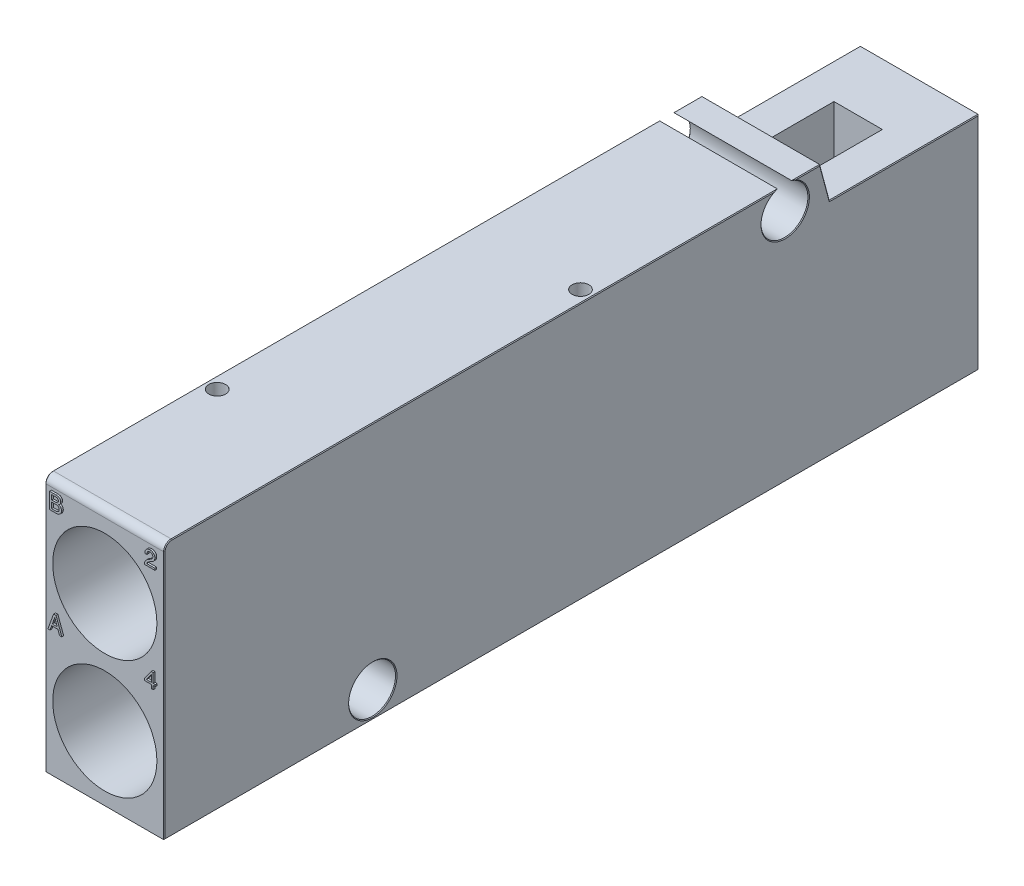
SolidWorks part; units mm, degrees
ref_plane "Front" through (0, 0, 0) normal (0, 0, 1) x (1, 0, 0)
ref_plane "Top" through (0, 0, 0) normal (0, 1, 0) x (1, 0, 0)
ref_plane "Right" through (0, 0, 0) normal (1, 0, 0) x (0, 0, -1)
sketch "Base_Sketch" plane through (0, 0, 0) normal (1, 0, 0) x (0, 0, -1)
  line L0 (-54.7, -17.25) -> (54.7, 17.25) construction
  line L1 (-54.7, 17.25) -> (54.7, 17.25)
  line L2 (-54.7, 17.25) -> (-54.7, -17.25)
  line L3 (-54.7, -17.25) -> (54.7, -17.25)
  line L4 (54.7, 17.25) -> (54.7, -17.25)
  dimension "Length" = 109.4
  dimension "Height" = 34.5
extrude "Base" add sketch "Base_Sketch" along normal mid plane 16
sketch "Valve Cut_Sketch" plane through (0, 0, 0) normal (1, 0, 0) x (0, 0, -1)
  line L0 (33.4138, 17.25) -> (34.7, 12.45)
  line L1 (54.7, 17.25) -> (-54.7, 17.25) construction
  line L2 (34.7, 12.45) -> (54.7, 12.45)
  line L3 (54.7, -17.25) -> (54.7, 17.25) construction
  dimension "Dist" = 20
  dimension "Height" = 4.8
  dimension "Angle" = 75
extrude "Valve Cut" cut sketch "Valve Cut_Sketch" against normal through all and the other way through all
sketch "Valve Connector_Sketch" plane through (0, 12.45, 0) normal (0, 1, 0) x (-1, 0, 0)
  line L0 (0, 0) -> (0, -53.7788) construction
  line L1 (-8, -54.7) -> (8, -54.7) construction
  line L2 (3.25, -37.7) -> (-3.25, -37.7)
  line L3 (3.25, -37.7) -> (3.25, -46.5)
  line L4 (3.25, -46.5) -> (-3.25, -46.5)
  line L5 (-3.25, -37.7) -> (-3.25, -46.5)
  dimension "Length" = 8.8
  dimension "Width" = 6.5
  dimension "Loc" = 8.2
extrude "Valve Connector" cut sketch "Valve Connector_Sketch" against normal blind 8
sketch "Bottom Angle_Sketch" [suppressed] plane through (0, 0, 0) normal (1, 0, 0) x (0, 0, -1)
  line L0 (-42.1, -20.5) -> (-56.1, -18.0314)
  line L1 (-56.1, -20.5) -> (56.1, -20.5) construction
  line L2 (-56.1, 20.5) -> (-56.1, -20.5) construction
  dimension "Angle" = 10
  dimension "Loc" = 14
extrude "Bottom Angle" [suppressed] cut sketch "Bottom Angle_Sketch" against normal through all and the other way through all
sketch "Rail Groove_Sketch" [suppressed] plane through (0, 0, 0) normal (1, 0, 0) x (0, 0, -1)
  line L0 (-28.5, -20.5) -> (-28.5, -17.3527)
  line L1 (-42.1, -20.5) -> (56.1, -20.5) construction
  line L2 (-28.5, -17.3527) -> (-30.5, -17)
  line L3 (-30.5, -17) -> (-30.5, -15.5)
  line L4 (-30.5, -15.5) -> (4.5, -15.5)
  line L5 (4.5, -15.5) -> (4.5, -20.5)
  line L6 (4.5, -20.5) -> (-28.5, -20.5)
  line L8 (-56.1, -18.0314) -> (-42.1, -20.5) construction
  line L9 (56.1, -20.5) -> (56.1, 15.7) construction
  point P12 (-13, -15.5)
  dimension "Width" = 35
  dimension "Bot_Width" = 33
  dimension "Height" = 6.3
  dimension "Groove_Height" = 1.5
  dimension "Loc" = 69.1
extrude "Rail Groove" [suppressed] cut sketch "Rail Groove_Sketch" against normal through all and the other way through all
sketch "Guide Holes_Sketch" plane through (0, 0, 0) normal (1, 0, 0) x (0, 0, -1)
  line L0 (54.7, -17.25) -> (54.7, 12.45) construction
  line L1 (33.4138, 17.25) -> (-54.7, 17.25) construction
  line L2 (-54.7, 17.25) -> (-54.7, -17.25) construction
  line L3 (-54.7, -17.25) -> (54.7, -17.25) construction
  circle A0 centre (28.7, 14.25) radius 3.15
  circle A1 centre (-26.7, -13.75) radius 3.15
  dimension "Dia" = 6.3
  dimension "Loc_Z" = 26
  dimension "Loc_Y" = 3
  dimension "Loc_Z-Bot" = 28
  dimension "Loc_Y-Bot" = 3.5
extrude "Guide Holes" cut sketch "Guide Holes_Sketch" against normal through all and the other way through all
fillet "Radius" radius 1 1 edges at (0, 17.25, 54.7)
sketch "2_Sketch" plane through (-1.8149, 2.2956, 54.7) normal (0, 0, 1) x (1, 0, 0)
  line L1 (-6.1851, 14.9544) -> (9.8149, 14.9544) construction
  line L2 (9.8149, 13.9544) -> (9.8149, -19.5456) construction
  text T0 "2"
  dimension "D1" = 2.5
  dimension "Loc_Y" = 3.5
extrude "2" add sketch "2_Sketch" along normal blind 0.25
sketch "B_Sketch" plane through (0, 0, 54.7) normal (0, 0, 1) x (1, 0, 0)
  line L1 (-8, 16.25) -> (-8, -17.25) construction
  text T0 "B"
  dimension "D1" = 0.6
extrude "B" add sketch "B_Sketch" against normal up to surface (0.25 mm away)
sketch "4_Sketch" plane through (0, 0, 54.7) normal (0, 0, 1) x (1, 0, 0)
  line L0 (8, -17.25) -> (-8, -17.25) construction
  text T0 "4"
  dimension "Loc_Y" = 17
extrude "4" add sketch "4_Sketch" against normal up to surface (0.25 mm away)
sketch "A_Sketch" plane through (0, 0, 54.7) normal (0, 0, 1) x (1, 0, 0)
  line L0 (8, -17.25) -> (-8, -17.25) construction
  text T0 "A"
  dimension "D1" = 17
extrude "A" add sketch "A_Sketch" against normal up to surface (0.25 mm away)
sketch "Fitting Hole_Sketch" plane through (0, 0, 54.7) normal (0, 0, 1) x (1, 0, 0)
  line L0 (8, -17.25) -> (-8, -17.25) construction
  circle A0 centre (0, 7.45) radius 7
  circle A1 centre (0, -8.55) radius 7
  dimension "Dia" = 14
  dimension "Loc_Y-Bot" = 8.7
  dimension "Loc_Y-Top" = 24.7
extrude "Fitting Hole" cut sketch "Fitting Hole_Sketch" against normal blind 14.6
sketch "Latch Cut_Sketch" [suppressed] plane through (0, 0, -56.1) normal (0, 0, -1) x (-1, 0, 0)
  line L0 (8, -20.5) -> (8, 15.7) construction
  line L1 (-8, 13.5) -> (8, 13.5)
  line L2 (-8, 13.5) -> (-8, 8.5)
  line L3 (-8, 8.5) -> (8, 8.5)
  line L4 (8, 13.5) -> (8, 8.5)
  line L5 (-8, -20.5) -> (-8, 15.7) construction
  line L6 (-8, -20.5) -> (8, -20.5) construction
  dimension "Loc_Y" = 29
  dimension "Height" = 5
extrude "Latch Cut" [suppressed] cut sketch "Latch Cut_Sketch" against normal blind 4.6
sketch "Latch_Sketch" [suppressed] plane through (0, 8.5, 0) normal (0, 1, 0) x (-1, 0, 0)
  line L0 (7.75, -51.5) -> (7.75, -55.85)
  line L1 (8, -51.5) -> (-8, -51.5) construction
  line L2 (7.75, -55.85) -> (1.95, -55.85)
  line L3 (8, -56.1) -> (8, -36.1) construction
  line L4 (7.75, -53.675) -> (8, -53.675) construction
  line L5 (4.85, -55.85) -> (4.85, -56.1) construction
  line L6 (-8, -56.1) -> (8, -56.1) construction
  dimension "Length" = 5.8
  dimension "Offset" = 0.25
extrude "Latch" [suppressed] add sketch "Latch_Sketch" along normal up to surface (5 mm away) thin
chamfer "Chamfer1" distance 0.1 angle 45 20 edges at (8, -2.4, -54.7) (-8, 17.25, -31.5372) (-8, 12.45, -44.7) (-8, 14.85, -34.0569) (8, 17.25, -31.5372) (8, 14.85, -34.0569) (8, 12.45, -44.7) (-8, 17.25, 12.9802) (-8, 11.1, -28.7) (8, 17.25, 12.9802) (8, 11.1, -28.7) (-8, -2.4, -54.7) (-8, -13.75, 23.55) (8, -13.75, 23.55) (-8, -17.25, 0) (-8, -0.5, 54.7) (8, -0.5, 54.7) (-8, 16.9571, 54.4071) (8, 16.9571, 54.4071) (8, -17.25, 0)
sketch "Threads" plane through (0, 17.25, 0) normal (0, 1, 0) x (-1, 0, 0)
  line L1 (-7.9, 54.7) -> (7.9, 54.7) construction
  line L2 (-8, -27.2329) -> (-8, 53.7) construction
  line L3 (8, 53.7) -> (8, -27.2329) construction
  circle A0 centre (6.4, 33.2) radius 1.125
  circle A1 centre (-6.4, -2.8) radius 1.125
  dimension "D2" = 21.5
  dimension "Diameter" = 2.25
  dimension "D1" = 36
  dimension "Hole2 inside" = 1.6
  dimension "hole1 inside" = 1.6
extrude "Thread Holes" cut sketch "Threads" against normal blind 3
